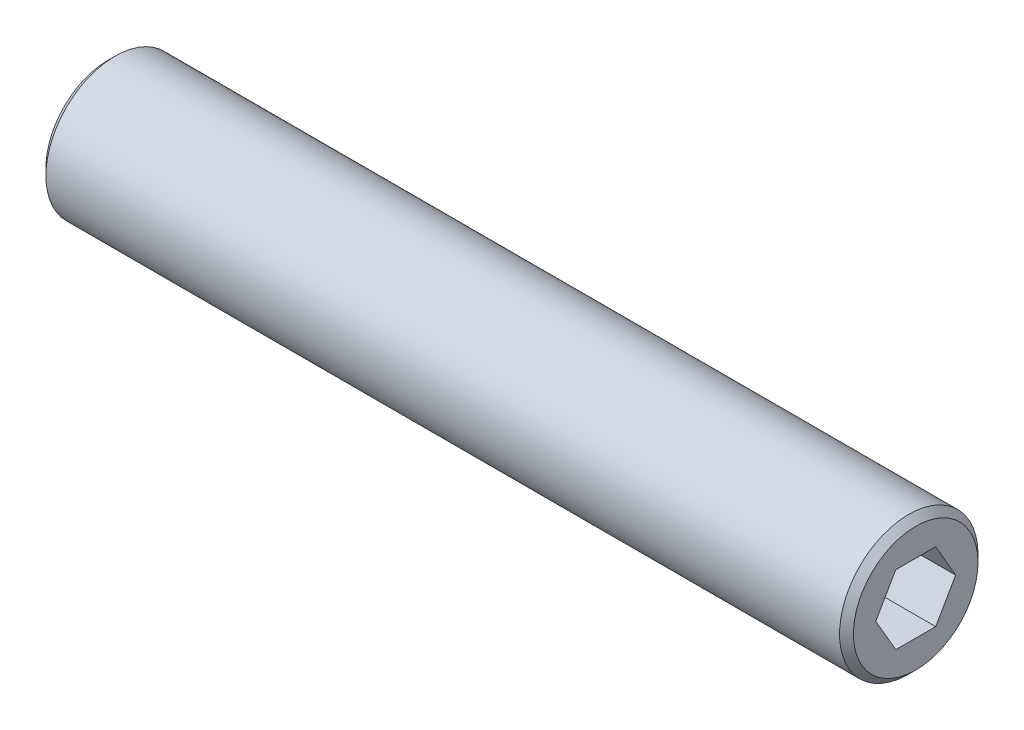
SolidWorks part; units mm, degrees
ref_plane "Face" through (0, 0, 0) normal (0, 0, 1) x (1, 0, 0)
ref_plane "Dessus" through (0, 0, 0) normal (0, 1, 0) x (1, 0, 0)
ref_plane "Droite" through (0, 0, 0) normal (1, 0, 0) x (0, 0, -1)
sketch "Esquisse1" plane through (0, 0, 0) normal (1, 0, 0) x (0, 0, -1)
  circle A0 centre (0, 0) radius 3
  dimension "D1" = 6
extrude "Base-Extrusion" add sketch "Esquisse1" along normal mid plane 35
sketch "Esquisse5" plane through (-17.5, 0, 0) normal (-1, 0, 0) x (0, 0, 1)
  line L0 (3.15, 0) -> (-3.15, 0) construction
  line L1 (1.7321, 0) -> (0.866, 1.5)
  line L2 (0.866, 1.5) -> (-0.866, 1.5)
  line L3 (-0.866, 1.5) -> (-1.7321, 0)
  line L4 (-1.7321, 0) -> (-0.866, -1.5)
  line L5 (-0.866, -1.5) -> (0.866, -1.5)
  line L6 (0.866, -1.5) -> (1.7321, 0)
  circle A0 centre (0, 0) radius 1.5 construction
  dimension "D1" = 3
extrude "Enlèv. mat.-Extru.3" cut sketch "Esquisse5" against normal blind 4
sketch "Esquisse7" plane through (17.5, 0, 0) normal (1, 0, 0) x (0, 0, -1)
  line L0 (0.866, 1.5) -> (1.7321, 0) construction
  line L1 (1.7321, 0) -> (0.866, -1.5) construction
  line L2 (0.866, -1.5) -> (-0.866, -1.5) construction
  line L3 (-0.866, -1.5) -> (-1.7321, 0) construction
  line L4 (-1.7321, 0) -> (-0.866, 1.5) construction
  line L5 (-0.866, 1.5) -> (0.866, 1.5) construction
  line L6 (0.866, 1.5) -> (1.7321, 0)
  line L7 (1.7321, 0) -> (0.866, -1.5)
  line L8 (0.866, -1.5) -> (-0.866, -1.5)
  line L9 (-0.866, -1.5) -> (-1.7321, 0)
  line L10 (-1.7321, 0) -> (-0.866, 1.5)
  line L11 (-0.866, 1.5) -> (0.866, 1.5)
extrude "Enlèv. mat.-Extru.4" cut sketch "Esquisse7" against normal blind 4
chamfer "Chanfrein2" distance 0.3 angle 45
